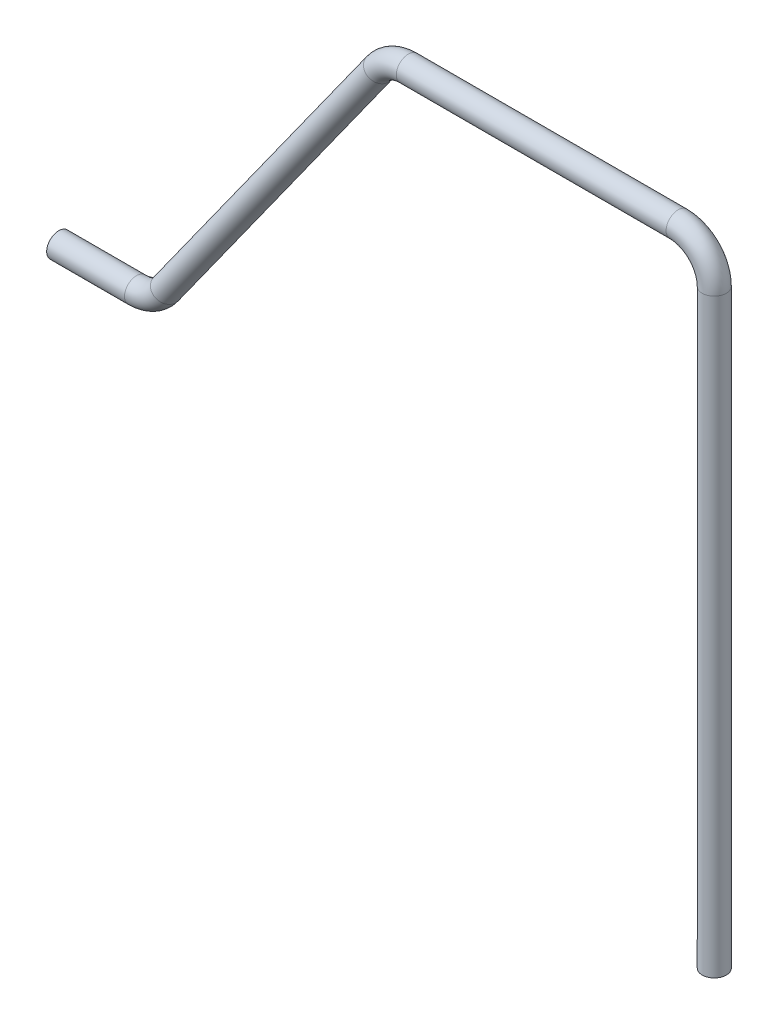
SolidWorks part; units mm, degrees
ref_plane "Plane1" through (0, 0, 0) normal (0, 0, 1) x (1, 0, 0)
ref_plane "Plane2" through (0, 0, 0) normal (0, 1, 0) x (1, 0, 0)
ref_plane "Plane3" through (0, 0, 0) normal (1, 0, 0) x (0, 0, -1)
sketch "Sketch1" plane through (0, 0, 0) normal (0, 0, 1) x (1, 0, 0)
  line L0 (0, 0) -> (10.2522, 0)
  line L1 (0, 0) -> (0, 43.18) construction
  line L2 (0, 43.18) -> (43.6095, 43.18) construction
  line L3 (42.1848, 41.1896) -> (14.1248, 1.9904)
  line L4 (46.0573, 43.18) -> (81.5975, 43.18)
  line L5 (86.36, 38.4175) -> (86.36, -39.37)
  arc A0 (42.1848, 41.1896) -> (46.0573, 43.18) centre (46.0573, 38.4175) cw
  arc A1 (86.36, 38.4175) -> (81.5975, 43.18) centre (81.5975, 38.4175) ccw
  arc A2 (10.2522, 0) -> (14.1248, 1.9904) centre (10.2522, 4.7625) ccw
  point P12 (86.36, 43.18)
  point P15 (12.7, 0)
  dimension "D6" = 4.7625
  dimension "D1" = 43.18
  dimension "D2" = 35.5402
  dimension "D3" = 86.36
  dimension "D4" = 12.7
  dimension "D5" = 82.55
sketch "Sketch2" plane through (0, 0, 0) normal (1, 0, 0) x (0, 0, -1)
  circle A0 centre (0, 0) radius 1.5875
  dimension "D1" = 3.175
sweep "Base-Sweep" add profiles "Sketch2" path "Sketch1"
